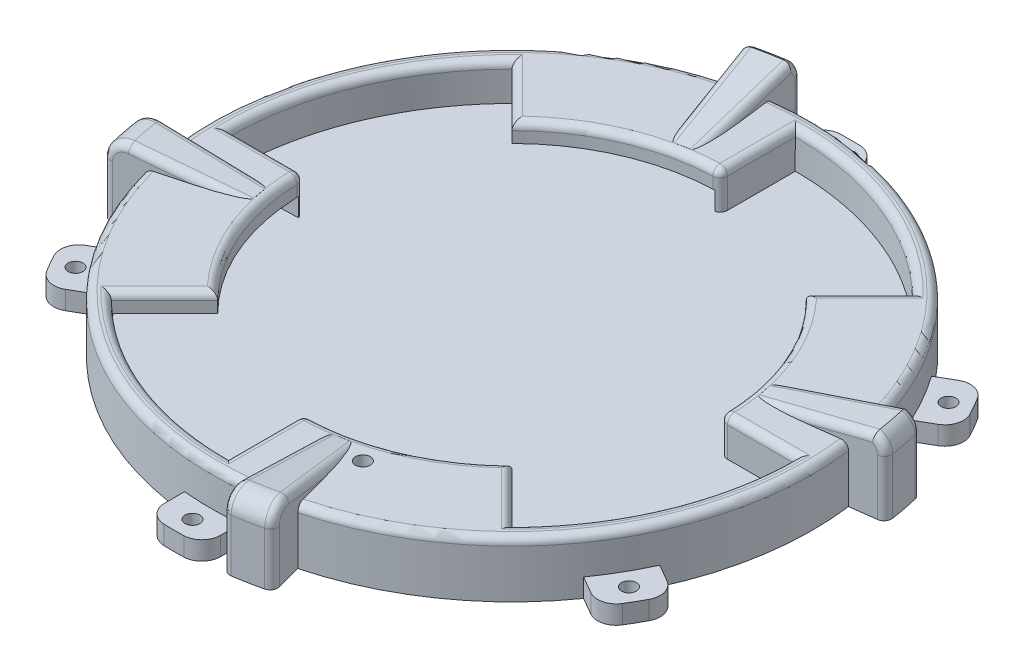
SolidWorks part; units mm, degrees
ref_plane "Front Plane" through (0, 0, 0) normal (0, 0, 1) x (1, 0, 0)
ref_plane "Top Plane" through (0, 0, 0) normal (0, 1, 0) x (1, 0, 0)
ref_plane "Right Plane" through (0, 0, 0) normal (1, 0, 0) x (0, 0, -1)
sketch "Sketch1" plane through (0, 0, 0) normal (0, 1, 0) x (1, 0, 0)
  circle A0 centre (0, 0) radius 80.985
  dimension "D1" = 161.97
extrude "Boss-Extrude1" add sketch "Sketch1" along normal blind 5
sketch "Sketch2" plane through (0, 5, 0) normal (0, 1, 0) x (1, 0, 0)
  circle A0 centre (0, 0) radius 76.25
  circle A2 centre (0, 0) radius 80.985
  dimension "D1" = 152.5
extrude "Boss-Extrude2" add sketch "Sketch2" along normal blind 5
sketch "Sketch3" plane through (0, 10, 0) normal (0, 1, 0) x (1, 0, 0)
  line L0 (0, 76.25) -> (0, 56)
  line L1 (0, 80.985) -> (0, 0) construction
  line L2 (80.985, 0) -> (0, 0) construction
  line L3 (76.25, 0) -> (56, 0)
  line L4 (0, -80.985) -> (0, 0) construction
  line L5 (0, -76.25) -> (0, -56)
  line L6 (-80.985, 0) -> (0, 0) construction
  line L7 (-76.25, 0) -> (-56, 0)
  line L8 (53.9169, 53.9169) -> (39.598, 39.598)
  line L9 (57.265, 57.265) -> (0, 0) construction
  line L10 (76.25, 0) -> (56, 0)
  line L11 (80.985, 0) -> (0, 0) construction
  line L12 (53.9169, -53.9169) -> (39.598, -39.598)
  line L13 (57.265, -57.265) -> (0, 0) construction
  line L14 (0, -76.25) -> (0, -56)
  line L15 (0, -80.985) -> (0, 0) construction
  line L16 (-53.9169, -53.9169) -> (-39.598, -39.598)
  line L17 (-57.265, -57.265) -> (0, 0) construction
  line L18 (-76.25, 0) -> (-56, 0)
  line L19 (-80.985, 0) -> (0, 0) construction
  line L20 (-53.9169, 53.9169) -> (-39.598, 39.598)
  line L21 (-57.265, 57.265) -> (0, 0) construction
  circle A0 centre (0, 0) radius 80.985
  circle A3 centre (0, 0) radius 56
  arc A4 (0, -76.25) -> (53.9169, -53.9169) centre (0, 0) ccw
  point P20 (0, 0)
  point P41 (0, 0)
  dimension "D2" = 4
  dimension "D3" = 8
extrude "Boss-Extrude3" add sketch "Sketch3" along normal blind 5 contours A3 L0 L20 M5 | A3 L3 L8 M5 | A3 L5 L12 M5 | A3 L7 L16 M5 | M4 M5
sketch "Sketch4" plane through (0, 15, 0) normal (0, 1, 0) x (1, 0, 0)
  line L0 (0, 56) -> (0, 76.25)
  line L1 (-1.4688, 55.9807) -> (-1.999, 76.1874)
  line L2 (0, 76.25) -> (0, 0) construction
  line L3 (76.25, 0) -> (0, 0) construction
  line L4 (55.9807, 1.4688) -> (76.1874, 1.999)
  line L5 (56, 0) -> (76.25, 0)
  line L6 (0, -76.25) -> (0, 0) construction
  line L7 (1.4688, -55.9807) -> (1.999, -76.1874)
  line L8 (0, -56) -> (0, -76.25)
  line L9 (-76.25, 0) -> (0, 0) construction
  line L10 (-55.9807, -1.4688) -> (-76.1874, -1.999)
  line L11 (-56, 0) -> (-76.25, 0)
  circle A0 centre (0, 0) radius 76.2136
  circle A1 centre (0, 0) radius 56
  point P24 (0, 0)
  dimension "D1" = 2
  dimension "D2" = 4
extrude "Boss-Extrude4" add sketch "Sketch4" against normal blind 11 contours A0 L1 M5 M4 | A0 L4 M9 M8 | A0 L7 M13 M12 | A0 L10 M17 M16
sketch "Sketch5" plane through (0, 0, 0) normal (0, -1, 0) x (1, 0, 0)
  line L0 (75.0583, 51.9952) -> (82.5583, 39.0048)
  line L1 (82.5583, 39.0048) -> (73.5837, 33.8233)
  line L2 (-7.5, 91) -> (7.5, 91)
  line L3 (-7.5, 91) -> (-7.5, 80.637)
  line L5 (7.5, 91) -> (7.5, 80.637)
  line L6 (75.0583, 51.9952) -> (66.0837, 46.8137)
  line L7 (82.5583, -39.0048) -> (75.0583, -51.9952)
  line L8 (75.0583, -51.9952) -> (66.0837, -46.8137)
  line L9 (82.5583, -39.0048) -> (73.5837, -33.8233)
  line L10 (7.5, -91) -> (-7.5, -91)
  line L11 (-7.5, -91) -> (-7.5, -80.637)
  line L12 (7.5, -91) -> (7.5, -80.637)
  line L13 (-75.0583, -51.9952) -> (-82.5583, -39.0048)
  line L14 (-82.5583, -39.0048) -> (-73.5837, -33.8233)
  line L15 (-75.0583, -51.9952) -> (-66.0837, -46.8137)
  line L16 (-82.5583, 39.0048) -> (-75.0583, 51.9952)
  line L17 (-75.0583, 51.9952) -> (-66.0837, 46.8137)
  line L18 (-82.5583, 39.0048) -> (-73.5837, 33.8233)
  circle A0 centre (0, 0) radius 80.985
  circle A1 centre (0, 0) radius 91
  point P32 (0, 0)
  dimension "D1" = 182
  dimension "D2" = 15
  dimension "D3" = 6
extrude "Boss-Extrude5" add sketch "Sketch5" against normal blind 5 contours L8 A1 L9 M3 | A1 L12 L11 M3 | L14 A1 L15 M3 | L1 A1 L6 M3 | L5 A1 L3 M3 | L17 A1 L18 M3
fillet "Fillet2" radius 5 12 edges at (-7.5, 2.5, -90.6904) (7.5, 2.5, -90.6904) (74.7902, 2.5, -51.8404) (82.2902, 2.5, -38.85) (82.2902, 2.5, 38.85) (74.7902, 2.5, 51.8404) (7.5, 2.5, 90.6904) (-7.5, 2.5, 90.6904) (-74.7902, 2.5, 51.8404) (-82.2902, 2.5, 38.85) (-82.2902, 2.5, -38.85) (-74.7902, 2.5, -51.8404)
sketch "Sketch6" plane through (0, 0, 0) normal (0, -1, 0) x (1, 0, 0)
  circle A0 centre (0, 86) radius 2
  arc A1 (2.6453, 90.9615) -> (-2.6453, 90.9615) centre (0, 0) ccw construction
  circle A2 centre (74.4782, 43) radius 2
  circle A3 centre (74.4782, -43) radius 2
  circle A4 centre (0, -86) radius 2
  circle A5 centre (-74.4782, -43) radius 2
  circle A6 centre (-74.4782, 43) radius 2
  point P5 (0, 91)
  point P18 (0, 0)
  dimension "D1" = 4
  dimension "D2" = 5
  dimension "D3" = 6
extrude "Cut-Extrude1" cut sketch "Sketch6" against normal through all
fillet "Fillet3" radius 2 4 edges at (56, 10, 0) (-56, 10, 0) (0, 10, -56) (0, 10, 56)
fillet "Fillet4" radius 2 20 edges at (46.7574, 15, -46.7574) (29.1796, 15, -70.4458) (0, 15, -67.1078) (-0.5616, 15, -56.5759) (-22.3192, 15, -51.36) (-46.7574, 15, -46.7574) (-70.4458, 15, -29.1796) (-67.1078, 15, 0) (-56.5759, 15, 0.5616) (-51.36, 15, 22.3192) (-46.7574, 15, 46.7574) (-29.1796, 15, 70.4458) (0, 15, 67.1078) (0.5616, 15, 56.5759) (22.3192, 15, 51.36) (46.7574, 15, 46.7574) (70.4458, 15, 29.1796) (67.1078, 15, 0) (56.5759, 15, -0.5616) (51.36, 15, -22.3192)
sketch "Sketch7" plane through (0, 15, 0) normal (0, 1, 0) x (1, 0, 0)
  line L0 (56.0827, 14.7895) -> (87.0249, 22.9492)
  line L1 (57.5333, 7.3427) -> (89.2759, 11.3938)
  line L2 (-14.7895, 56.0827) -> (-22.9492, 87.0249)
  line L3 (-7.3427, 57.5333) -> (-11.3938, 89.2759)
  line L4 (14.7895, -56.0827) -> (22.9492, -87.0249)
  line L5 (7.3427, -57.5333) -> (11.3938, -89.2759)
  line L6 (-56.0827, -14.7895) -> (-87.0249, -22.9492)
  line L7 (-57.5333, -7.3427) -> (-89.2759, -11.3938)
  arc A2 (-11.3938, 89.2759) -> (-22.9492, 87.0249) centre (0, 0) ccw
  arc A3 (-7.3427, 57.5333) -> (-14.7895, 56.0827) centre (0, 0) ccw
  arc A4 (89.2759, 11.3938) -> (87.0249, 22.9492) centre (0, 0) ccw
  arc A5 (57.5333, 7.3427) -> (56.0827, 14.7895) centre (0, 0) ccw
  arc A6 (11.3938, -89.2759) -> (22.9492, -87.0249) centre (0, 0) ccw
  arc A7 (7.3427, -57.5333) -> (14.7895, -56.0827) centre (0, 0) ccw
  arc A8 (-89.2759, -11.3938) -> (-87.0249, -22.9492) centre (0, 0) ccw
  arc A9 (-57.5333, -7.3427) -> (-56.0827, -14.7895) centre (0, 0) ccw
  point P21 (0, 0)
  dimension "D1" = 7.5
  dimension "D2" = 90
  dimension "D3" = 4
extrude "Boss-Extrude6" add sketch "Sketch7" along normal blind 5
ref_plane "Plane1" through (0, 0, 0) normal (-0.9816, 0, 0.1912) x (0.1912, 0, 0.9816)
sketch "Sketch8" plane through (0, 0, 0) normal (-0.9816, 0, 0.1912) x (0.1912, 0, 0.9816)
  line L0 (-57.8758, 15) -> (-89.8073, 20)
  line L1 (-89.8073, 20) -> (-57.8758, 20)
  line L2 (-57.8758, 20) -> (-57.8758, 15)
extrude "Cut-Extrude2" cut sketch "Sketch8" against normal through all and the other way through all
ref_plane "Plane2" through (0, 0, 0) normal (0.1912, 0, 0.9816) x (0.9816, 0, -0.1912)
sketch "Sketch9" plane through (0, 0, 0) normal (0.1912, 0, 0.9816) x (0.9816, 0, -0.1912)
  line L0 (57.8758, 15) -> (57.8758, 20)
  line L1 (57.8758, 20) -> (89.8073, 20)
  line L2 (89.8073, 20) -> (57.8758, 15)
extrude "Cut-Extrude3" cut sketch "Sketch9" against normal through all and the other way through all
ref_plane "Plane3" through (0, 0, 0) normal (0.9816, 0, -0.1912) x (-0.1912, 0, -0.9816)
sketch "Sketch10" plane through (0, 0, 0) normal (0.9816, 0, -0.1912) x (-0.1912, 0, -0.9816)
  line L0 (-57.8758, 15) -> (-90, 20)
  line L1 (-90, 20) -> (-57.8758, 20)
  line L2 (-57.8758, 20) -> (-57.8758, 15)
extrude "Cut-Extrude4" cut sketch "Sketch10" against normal through all and the other way through all
ref_plane "Plane4" through (0, 0, 0) normal (0.1912, 0, 0.9816) x (0.9816, 0, -0.1912)
sketch "Sketch11" plane through (0, 0, 0) normal (0.1912, 0, 0.9816) x (0.9816, 0, -0.1912)
  line L0 (-57.8758, 15) -> (-57.8758, 20)
  line L1 (-57.8758, 20) -> (-90, 20)
  line L2 (-90, 20) -> (-57.8758, 15)
extrude "Cut-Extrude5" cut sketch "Sketch11" against normal through all and the other way through all
sketch "Sketch12" plane through (0, 15, 0) normal (0, -1, 0) x (1, 0, 0)
  line L0 (21.7998, 82.6664) -> (20.6504, 78.3079)
  line L1 (22.9492, 87.0249) -> (20.6504, 78.3079) construction
  line L2 (20.6504, 78.3079) -> (22.9492, 87.0249)
  line L3 (10.8231, 84.8046) -> (11.3938, 89.2759)
  line L4 (10.2525, 80.3334) -> (11.3938, 89.2759) construction
  line L5 (11.3938, 89.2759) -> (10.2525, 80.3334)
  line L6 (78.3079, -20.6504) -> (87.0249, -22.9492)
  line L7 (89.2759, -11.3938) -> (80.3334, -10.2525)
  line L8 (-20.6504, -78.3079) -> (-22.9492, -87.0249)
  line L9 (-11.3938, -89.2759) -> (-10.2525, -80.3334)
  line L10 (-78.3079, 20.6504) -> (-87.0249, 22.9492)
  line L11 (-89.2759, 11.3938) -> (-80.3334, 10.2525)
  arc A0 (22.9492, 87.0249) -> (11.3938, 89.2759) centre (0, 0) ccw
  arc A1 (20.6504, 78.3079) -> (10.2525, 80.3334) centre (0, 0) ccw
  arc A2 (87.0249, -22.9492) -> (89.2759, -11.3938) centre (0, 0) ccw
  arc A3 (78.3079, -20.6504) -> (80.3334, -10.2525) centre (0, 0) ccw
  arc A4 (-22.9492, -87.0249) -> (-11.3938, -89.2759) centre (0, 0) ccw
  arc A5 (-20.6504, -78.3079) -> (-10.2525, -80.3334) centre (0, 0) ccw
  arc A6 (-87.0249, 22.9492) -> (-89.2759, 11.3938) centre (0, 0) ccw
  arc A7 (-78.3079, 20.6504) -> (-80.3334, 10.2525) centre (0, 0) ccw
  point P29 (0, 0)
  dimension "D1" = 4
extrude "Boss-Extrude7" add sketch "Sketch12" along normal up to surface (15 mm away) contours A1 M3 M4 M5 | A3 L6 A2 L7 | A5 L8 A4 L9 | L10 A6 L11 A7
fillet "Fillet5" radius 5 4 edges at (17.2083, 20, 88.3395) (-88.3395, 20, 17.2083) (-17.2083, 20, -88.3395) (88.3395, 20, -17.2083)
fillet "Fillet7" radius 2 24 edges at (88.4909, 17.6995, -11.2936) (86.2597, 17.6995, -22.7474) (-11.2936, 17.6995, -88.4909) (-22.7474, 17.6995, -86.2597) (22.9492, 7.0666, 87.0249) (22.3084, 18.471, 84.5951) (11.3938, 7.0666, 89.2759) (11.2551, 17.257, 88.189) (-89.2759, 7.0666, 11.3938) (-88.189, 17.257, 11.2551) (-87.0249, 7.0666, 22.9492) (-84.5951, 18.471, 22.3084) (89.2759, 7.5, -11.3938) (87.0249, 7.5, -22.9492) (70.1445, 17.2723, -18.4977) (71.9588, 17.2723, -9.1837) (-11.3938, 7.5, -89.2759) (-22.9492, 7.5, -87.0249) (-18.4977, 17.2723, -70.1445) (-9.1837, 17.2723, -71.9588) (18.134, 17.0371, 68.7655) (9.0032, 17.0371, 70.5441) (-70.5441, 17.0371, 9.0032) (-68.7655, 17.0371, 18.134)
sketch "Sketch13" plane through (0, 15, 0) normal (0, 1, 0) x (1, 0, 0)
  circle A0 centre (19.3241, -59.4601) radius 2
  point P2 (19.3241, -59.4601)
  dimension "D1" = 4
extrude "Cut-Extrude6" cut sketch "Sketch13" against normal through all
fillet "Fillet8" radius 2 4 edges at (-67.1578, 15, -45.2593) (45.2593, 15, -67.1578) (67.1578, 15, 45.2593) (-45.2593, 15, 67.1578)
